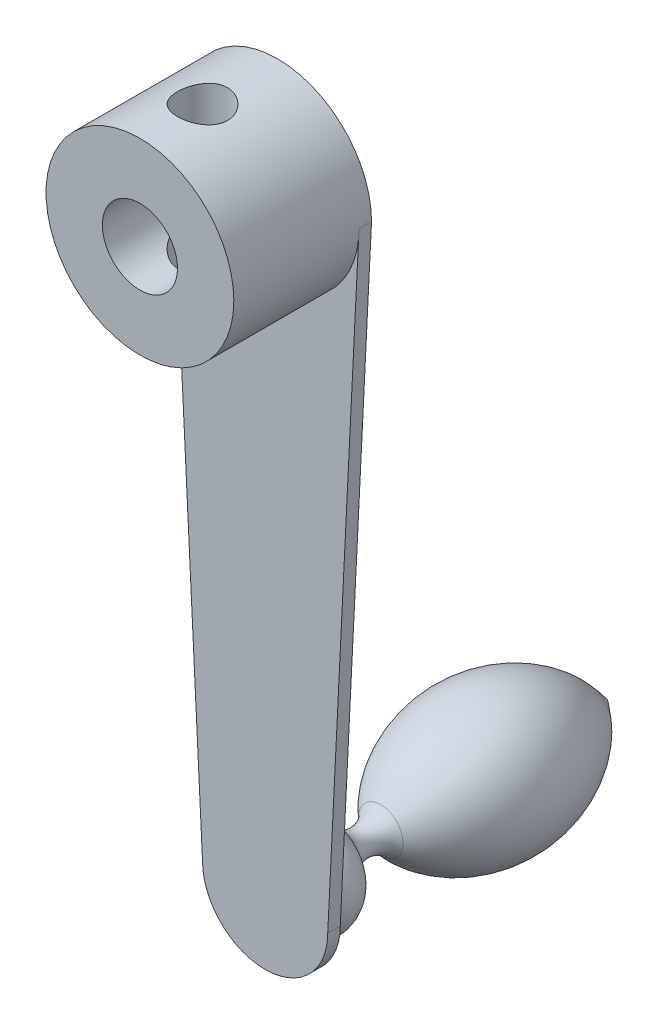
SolidWorks part; units mm, degrees
ref_plane "Front Plane" through (0, 0, 0) normal (0, 0, 1) x (1, 0, 0)
ref_plane "Top Plane" through (0, 0, 0) normal (0, 1, 0) x (1, 0, 0)
ref_plane "Right Plane" through (0, 0, 0) normal (1, 0, 0) x (0, 0, -1)
sketch "Sketch1" plane through (0, 0, 0) normal (0, 0, 1) x (1, 0, 0)
  line L0 (0, 0) -> (0, 50) construction
  line L1 (-7.5, 50) -> (-5, 0)
  line L2 (7.5, 50) -> (5, 0)
  arc A0 (-5, 0) -> (5, 0) centre (0, 0) ccw
  circle A2 centre (0, 50) radius 3
  arc A3 (7.5, 50) -> (-7.5, 50) centre (0, 50) ccw
  dimension "D2" = 10
  dimension "D3" = 6
  dimension "D4" = 15
  dimension "D1" = 50
extrude "Extrude1" add sketch "Sketch1" along normal blind 1
sketch "Sketch2" plane through (0, 0, 1) normal (0, 0, 1) x (1, 0, 0)
  circle A0 centre (0, 50) radius 3
  circle A1 centre (0, 50) radius 7.5
  dimension "D1" = 15
extrude "Extrude2" add sketch "Sketch2" along normal blind 10
sketch "Sketch3" plane through (0, 0, 0) normal (0, 1, 0) x (1, 0, 0)
  line L0 (0, 0) -> (0, -11) construction
  line L1 (-7.5, -11) -> (7.5, -11) construction
  circle A0 centre (0, -6) radius 2
  dimension "D1" = 4
  dimension "D2" = 5
extrude "Extrude3" cut sketch "Sketch3" along normal through all
sketch "Sketch5" plane through (0, 0, 0) normal (1, 0, 0) x (0, 0, -1)
  line L0 (0, 0) -> (26.3459, 0)
  line L1 (0, 0) -> (0, 3.0833)
  arc A0 (26.3459, 0) -> (24.7945, 1.8615) centre (-16.0912, -33.7895) ccw
  arc A1 (24.7945, 1.8615) -> (8.2389, 1.7834) centre (16.5504, -5.3271) ccw
  arc A2 (4.4309, 2.3607) -> (8.2389, 1.7834) centre (6.5147, 3.2584) ccw
  arc A3 (4.4309, 2.3607) -> (0, 3.0833) centre (1.9847, 1.3069) ccw
revolve "Revolve1" add sketch "Sketch5" angle 360 about L0
